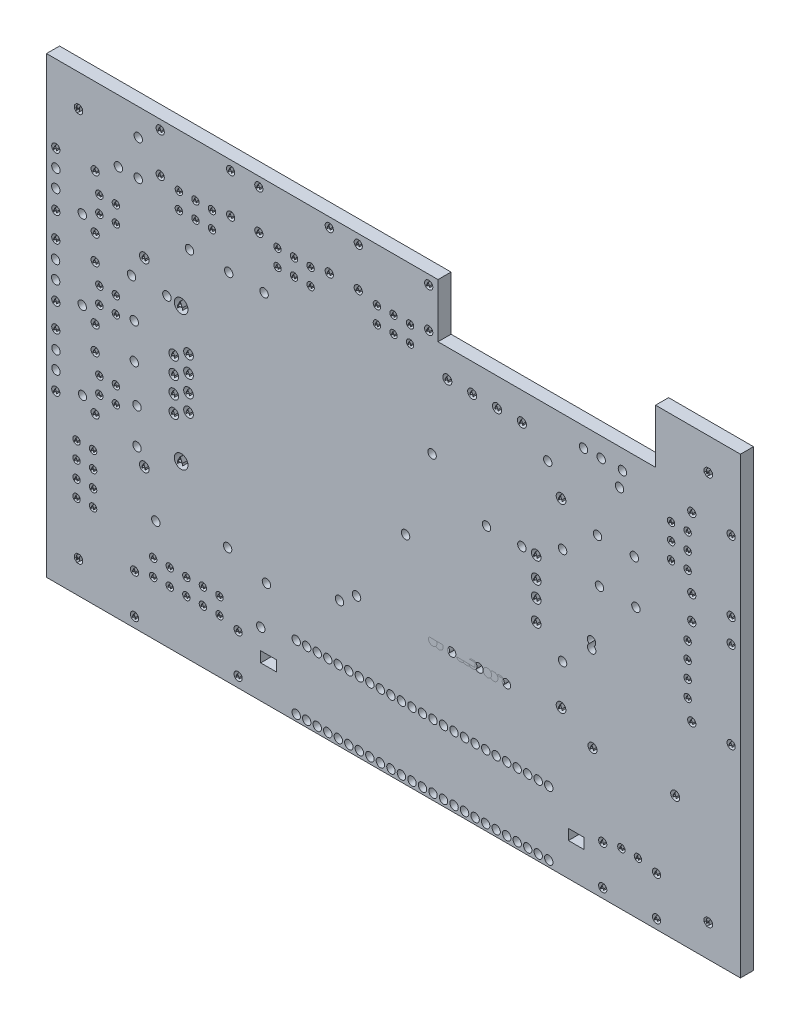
SolidWorks part; units mm, degrees
ref_plane "Front Plane" through (0, 0, 0) normal (0, 0, 1) x (1, 0, 0)
ref_plane "Top Plane" through (0, 0, 0) normal (0, 1, 0) x (1, 0, 0)
ref_plane "Right Plane" through (0, 0, 0) normal (1, 0, 0) x (0, 0, -1)
sketch "Model" plane through (0, 0, 0) normal (0, 0, 1) x (1, 0, 0)
  line L18 (0.127, 0.127) -> (83.8731, 0.127)
  line L19 (83.8731, 0.127) -> (83.8731, 54.8729)
  line L20 (83.8731, 54.8729) -> (73.627, 54.8729)
  line L21 (73.627, 54.8729) -> (73.627, 48.373)
  line L22 (73.627, 48.373) -> (47.373, 48.373)
  line L23 (47.373, 48.373) -> (47.373, 54.8729)
  line L24 (47.373, 54.8729) -> (0.127, 54.8729)
  line L25 (0.127, 54.8729) -> (0.127, 0.127)
  text T0 "A" font "TXT" height 0.4953
  text T1 "A" font "TXT" height 0.4953
  text T2 "A" font "TXT" height 0.4953
  text T3 "A" font "TXT" height 0.4953
  text T4 "A" font "TXT" height 0.4445
  text T5 "A" font "TXT" height 0.4445
  text T6 "A" font "TXT" height 0.4445
  text T7 "A" font "TXT" height 0.4445
  text T8 "A" font "TXT" height 0.4445
  text T9 "A" font "TXT" height 0.4445
  text T10 "A" font "TXT" height 0.4953
  text T11 "A" font "TXT" height 0.4953
  text T12 "A" font "TXT" height 0.4953
  text T13 "A" font "TXT" height 0.4953
  text T14 "A" font "TXT" height 0.4445
  text T15 "A" font "TXT" height 0.4445
  text T16 "A" font "TXT" height 0.4445
  text T17 "A" font "TXT" height 0.4445
  text T18 "A" font "TXT" height 0.4445
  text T19 "A" font "TXT" height 0.4445
  text T20 "A" font "TXT" height 0.4953
  text T21 "A" font "TXT" height 0.4953
  text T22 "A" font "TXT" height 0.4953
  text T23 "A" font "TXT" height 0.4953
  text T24 "A" font "TXT" height 0.4445
  text T25 "A" font "TXT" height 0.4445
  text T26 "A" font "TXT" height 0.4445
  text T27 "A" font "TXT" height 0.4445
  text T28 "A" font "TXT" height 0.4445
  text T29 "A" font "TXT" height 0.4445
  text T30 "A" font "TXT" height 0.4953
  text T31 "A" font "TXT" height 0.4953
  text T32 "A" font "TXT" height 0.4953
  text T33 "A" font "TXT" height 0.4953
  text T34 "A" font "TXT" height 0.4445
  text T35 "A" font "TXT" height 0.4445
  text T36 "A" font "TXT" height 0.4445
  text T37 "A" font "TXT" height 0.4445
  text T38 "A" font "TXT" height 0.4953
  text T39 "A" font "TXT" height 0.4953
  text T40 "A" font "TXT" height 0.4953
  text T41 "A" font "TXT" height 0.4953
  text T42 "A" font "TXT" height 0.4445
  text T43 "A" font "TXT" height 0.4445
  text T44 "A" font "TXT" height 0.4445
  text T45 "A" font "TXT" height 0.4445
  text T46 "A" font "TXT" height 0.4953
  text T47 "A" font "TXT" height 0.4953
  text T48 "A" font "TXT" height 0.4953
  text T49 "A" font "TXT" height 0.4953
  text T50 "A" font "TXT" height 0.4445
  text T51 "A" font "TXT" height 0.4445
  text T52 "A" font "TXT" height 0.4445
  text T53 "A" font "TXT" height 0.4445
  text T54 "A" font "TXT" height 0.4953
  text T55 "A" font "TXT" height 0.4953
  text T56 "A" font "TXT" height 0.4953
  text T57 "A" font "TXT" height 0.4953
  text T58 "A" font "TXT" height 0.4445
  text T59 "A" font "TXT" height 0.4445
  text T60 "A" font "TXT" height 0.4445
  text T61 "A" font "TXT" height 0.4445
  text T62 "A" font "TXT" height 0.4445
  text T63 "A" font "TXT" height 0.4445
  text T64 "A" font "TXT" height 0.4445
  text T65 "A" font "TXT" height 0.4445
  text T66 "A" font "TXT" height 0.4445
  text T67 "A" font "TXT" height 0.4445
  text T68 "A" font "TXT" height 0.5461
  text T69 "A" font "TXT" height 0.5461
  text T70 "A" font "TXT" height 0.5461
  text T71 "A" font "TXT" height 0.5461
  text T72 "M" font "TXT" height 0.5
  text T73 "M" font "TXT" height 0.5
  text T74 "M" font "TXT" height 0.5
  text T75 "M" font "TXT" height 0.5
  text T76 "A" font "TXT" height 0.5842
  text T77 "A" font "TXT" height 0.5842
  text T78 "A" font "TXT" height 0.5842
  text T79 "A" font "TXT" height 0.5842
  text T80 "A" font "TXT" height 0.5842
  text T81 "A" font "TXT" height 0.5842
  text T82 "A" font "TXT" height 0.5842
  text T83 "A" font "TXT" height 0.5842
  text T84 "A" font "TXT" height 0.8255
  text T85 "A" font "TXT" height 0.8255
  text T86 "A" font "TXT" height 0.5842
  text T87 "A" font "TXT" height 0.5842
  text T88 "A" font "TXT" height 0.5842
  text T89 "A" font "TXT" height 0.5842
  text T90 "A" font "TXT" height 0.5842
  text T91 "A" font "TXT" height 0.5842
  text T92 "A" font "TXT" height 0.5842
  text T93 "A" font "TXT" height 0.5842
  text T94 "A" font "TXT" height 0.4953
  text T95 "A" font "TXT" height 0.4953
  text T96 "A" font "TXT" height 0.4953
  text T97 "A" font "TXT" height 0.4953
  text T98 "A" font "TXT" height 0.4445
  text T99 "A" font "TXT" height 0.4445
  text T100 "A" font "TXT" height 0.4445
  text T101 "A" font "TXT" height 0.4445
  text T102 "A" font "TXT" height 0.4445
  text T103 "A" font "TXT" height 0.4445
  text T104 "A" font "TXT" height 0.4445
  text T105 "A" font "TXT" height 0.4445
  text T106 "A" font "TXT" height 0.4445
  text T107 "A" font "TXT" height 0.4445
  text T108 "A" font "TXT" height 0.4953
  text T109 "A" font "TXT" height 0.4953
  text T110 "A" font "TXT" height 0.4953
  text T111 "A" font "TXT" height 0.4953
  text T112 "A" font "TXT" height 0.4445
  text T113 "A" font "TXT" height 0.4445
  text T114 "A" font "TXT" height 0.4445
  text T115 "A" font "TXT" height 0.4445
  text T116 "A" font "TXT" height 0.4445
  text T117 "A" font "TXT" height 0.4445
  text T118 "A" font "TXT" height 0.5461
  text T119 "A" font "TXT" height 0.5461
  text T120 "A" font "TXT" height 0.4953
  text T121 "A" font "TXT" height 0.4953
  text T122 "A" font "TXT" height 0.4953
  text T123 "A" font "TXT" height 0.4953
  text T124 "A" font "TXT" height 0.4445
  text T125 "A" font "TXT" height 0.4445
  text T126 "A" font "TXT" height 0.4445
  text T127 "A" font "TXT" height 0.4445
  circle B0 centre (30.26, 0.8893) radius 0.508
  circle B1 centre (31.53, 0.8893) radius 0.508
  circle B2 centre (32.8, 0.8893) radius 0.508
  circle B3 centre (34.07, 0.8893) radius 0.508
  circle B4 centre (32.8, 8.6109) radius 0.508
  circle B5 centre (4.445, 40.2717) radius 0.508
  circle B6 centre (44.23, 0.8893) radius 0.508
  circle B7 centre (11.1999, 47.3664) radius 0.508
  circle B8 centre (10.3886, 36.8046) radius 0.508
  circle B9 centre (4.4323, 30.7213) radius 0.508
  circle B10 centre (10.7188, 32.2453) radius 0.508
  circle B11 centre (65.9, 26.3665) radius 0.508
  circle B12 centre (65.9181, 25.5499) radius 0.508
  circle B13 centre (41.69, 8.6109) radius 0.508
  circle B14 centre (4.4704, 21.3106) radius 0.4953
  circle B15 centre (11.049, 23.5204) radius 0.508
  circle B16 centre (40.42, 0.8893) radius 0.508
  circle B17 centre (37.88, 0.8893) radius 0.508
  circle B18 centre (8.8001, 47.3664) radius 0.508
  circle B19 centre (37.5437, 16.8923) radius 0.508
  circle B20 centre (11.049, 19.2532) radius 0.508
  circle B21 centre (35.34, 0.8893) radius 0.508
  circle B22 centre (13.3203, 12.5999) radius 0.508
  circle B23 centre (14.6558, 36.8046) radius 0.508
  circle B24 centre (17.3835, 42.9999) radius 0.508
  circle B25 centre (26.3835, 42.9999) radius 0.508
  circle B26 centre (48.04, 0.8893) radius 0.508
  circle B27 centre (51.85, 0.8893) radius 0.508
  circle B28 centre (55.66, 0.8893) radius 0.508
  circle B29 centre (59.47, 0.8893) radius 0.508
  circle B30 centre (10.7188, 27.9781) radius 0.508
  circle B31 centre (53.2257, 32.0421) radius 0.508
  circle B32 centre (49.31, 8.6109) radius 0.508
  circle B33 centre (53.1368, 8.6109) radius 0.508
  circle B34 centre (56.93, 8.6109) radius 0.508
  circle B35 centre (60.74, 8.6109) radius 0.508
  circle B36 centre (66.8569, 32.5603) radius 0.508
  circle B37 centre (71.2569, 32.5603) radius 0.508
  circle B38 centre (69.2798, 44.1) radius 0.508
  circle B39 centre (22.1163, 42.9999) radius 0.508
  circle B40 centre (11.1999, 51.6336) radius 0.508
  circle B41 centre (69.6331, 46.0332) radius 0.508
  circle B42 centre (71.0692, 37.7698) radius 0.508
  circle B43 centre (39.15, 0.8893) radius 0.508
  circle B44 centre (25.9842, 7.8486) radius 0.508
  circle B45 centre (26.67, 12.7762) radius 0.508
  circle B46 centre (67.0669, 46.0332) radius 0.508
  circle B47 centre (66.6242, 37.7698) radius 0.508
  circle B48 centre (30.26, 8.6109) radius 0.508
  circle B49 centre (62.4078, 22.4663) radius 0.508
  circle B50 centre (62.4078, 34.1884) radius 0.508
  circle B51 centre (1.27, 24.4856) radius 0.508
  circle B52 centre (1.27, 22.3774) radius 0.508
  circle B53 centre (1.2192, 33.909) radius 0.508
  circle B54 centre (1.2319, 31.7881) radius 0.508
  circle B55 centre (1.2573, 43.4594) radius 0.508
  circle B56 centre (1.2446, 41.3385) radius 0.508
  circle B57 centre (31.53, 8.6109) radius 0.508
  circle B58 centre (34.07, 8.6109) radius 0.508
  circle B59 centre (21.9817, 14.1747) radius 0.508
  circle B60 centre (35.3261, 8.6109) radius 0.508
  circle B61 centre (60.6184, 42.5252) radius 0.508
  circle B62 centre (46.6598, 36.2966) radius 0.508
  circle B63 centre (43.4594, 26.2636) radius 0.508
  circle B64 centre (35.4838, 15.3924) radius 0.508
  circle B65 centre (36.61, 0.8893) radius 0.508
  circle B66 centre (36.61, 8.6109) radius 0.508
  circle B67 centre (58.2, 0.8893) radius 0.508
  circle B68 centre (64.9333, 46.0332) radius 0.508
  circle B69 centre (58.2, 8.6109) radius 0.508
  circle B70 centre (59.47, 8.6109) radius 0.508
  circle B71 centre (60.74, 0.8893) radius 0.508
  circle B72 centre (46.77, 0.8893) radius 0.508
  circle B73 centre (47.498, 16.764) radius 0.508
  circle B74 centre (46.77, 8.6109) radius 0.508
  circle B75 centre (46.736, 16.764) radius 0.508
  circle B76 centre (48.04, 8.6109) radius 0.508
  circle B77 centre (48.26, 16.764) radius 0.508
  circle B78 centre (39.15, 8.6109) radius 0.508
  circle B79 centre (49.31, 0.8893) radius 0.508
  circle B80 centre (49.022, 16.764) radius 0.508
  circle B81 centre (50.58, 0.8893) radius 0.508
  circle B82 centre (50.8, 16.764) radius 0.508
  circle B83 centre (50.58, 8.6109) radius 0.508
  circle B84 centre (50.0634, 16.764) radius 0.508
  circle B85 centre (57.4929, 32.0421) radius 0.508
  circle B86 centre (45.5, 8.6109) radius 0.508
  circle B87 centre (37.88, 8.6109) radius 0.508
  circle B88 centre (45.5, 0.8893) radius 0.508
  circle B89 centre (56.93, 0.8893) radius 0.508
  circle B90 centre (55.626, 16.764) radius 0.508
  circle B91 centre (44.23, 8.6109) radius 0.508
  circle B92 centre (55.66, 8.6109) radius 0.508
  circle B93 centre (54.864, 16.764) radius 0.508
  circle B94 centre (42.96, 0.8893) radius 0.508
  circle B95 centre (54.39, 8.6109) radius 0.508
  circle B96 centre (53.34, 16.764) radius 0.508
  circle B97 centre (54.39, 0.8893) radius 0.508
  circle B98 centre (54.102, 16.764) radius 0.508
  circle B99 centre (40.42, 8.6109) radius 0.508
  circle B100 centre (41.69, 0.8893) radius 0.508
  circle B101 centre (42.96, 8.6109) radius 0.508
  circle B102 centre (53.12, 0.8893) radius 0.508
  circle B103 centre (52.324, 16.764) radius 0.508
  circle B104 centre (51.85, 8.6109) radius 0.508
  circle B105 centre (51.562, 16.764) radius 0.508
  circle B106 centre (46.2498, 49.0002) radius 0.4953
  circle B107 centre (46.2498, 53.75) radius 0.4953
  circle B108 centre (37.75, 53.75) radius 0.4953
  circle B109 centre (37.75, 49.0002) radius 0.4953
  circle B110 centre (41.9999, 48.5) radius 0.4445
  circle B111 centre (41.9999, 46.5) radius 0.4445
  circle B112 centre (39.9999, 48.5) radius 0.4445
  circle B113 centre (39.9999, 46.5) radius 0.4445
  circle B114 centre (43.9999, 46.5) radius 0.4445
  circle B115 centre (43.9999, 48.5) radius 0.4445
  circle B116 centre (34.2499, 49.0002) radius 0.4953
  circle B117 centre (34.2499, 53.75) radius 0.4953
  circle B118 centre (25.75, 53.75) radius 0.4953
  circle B119 centre (25.75, 49.0002) radius 0.4953
  circle B120 centre (29.9999, 48.5) radius 0.4445
  circle B121 centre (29.9999, 46.5) radius 0.4445
  circle B122 centre (27.9999, 48.5) radius 0.4445
  circle B123 centre (27.9999, 46.5) radius 0.4445
  circle B124 centre (31.9999, 46.5) radius 0.4445
  circle B125 centre (31.9999, 48.5) radius 0.4445
  circle B126 centre (22.35, 49.0002) radius 0.4953
  circle B127 centre (22.35, 53.75) radius 0.4953
  circle B128 centre (13.8501, 53.75) radius 0.4953
  circle B129 centre (13.8501, 49.0002) radius 0.4953
  circle B130 centre (18.1, 48.5) radius 0.4445
  circle B131 centre (18.1, 46.5) radius 0.4445
  circle B132 centre (16.1, 48.5) radius 0.4445
  circle B133 centre (16.1, 46.5) radius 0.4445
  circle B134 centre (20.1, 46.5) radius 0.4445
  circle B135 centre (20.1, 48.5) radius 0.4445
  circle B136 centre (6, 45.5498) radius 0.4953
  circle B137 centre (1.2502, 45.5498) radius 0.4953
  circle B138 centre (1.2502, 39.05) radius 0.4953
  circle B139 centre (6, 39.05) radius 0.4953
  circle B140 centre (6.5001, 43.2999) radius 0.4445
  circle B141 centre (8.5001, 43.2999) radius 0.4445
  circle B142 centre (6.5001, 41.2999) radius 0.4445
  circle B143 centre (8.5001, 41.2999) radius 0.4445
  circle B144 centre (6, 36.05) radius 0.4953
  circle B145 centre (1.2502, 36.05) radius 0.4953
  circle B146 centre (1.2502, 29.5501) radius 0.4953
  circle B147 centre (6, 29.5501) radius 0.4953
  circle B148 centre (6.5001, 33.8) radius 0.4445
  circle B149 centre (8.5001, 33.8) radius 0.4445
  circle B150 centre (6.5001, 31.8) radius 0.4445
  circle B151 centre (8.5001, 31.8) radius 0.4445
  circle B152 centre (6, 26.6499) radius 0.4953
  circle B153 centre (1.2502, 26.6499) radius 0.4953
  circle B154 centre (1.2502, 20.1501) radius 0.4953
  circle B155 centre (6, 20.1501) radius 0.4953
  circle B156 centre (6.5001, 24.4) radius 0.4445
  circle B157 centre (8.5001, 24.4) radius 0.4445
  circle B158 centre (6.5001, 22.4) radius 0.4445
  circle B159 centre (8.5001, 22.4) radius 0.4445
  circle B160 centre (10.75, 6.0998) radius 0.4953
  circle B161 centre (10.75, 1.35) radius 0.4953
  circle B162 centre (23.2499, 1.35) radius 0.4953
  circle B163 centre (23.2499, 6.0998) radius 0.4953
  circle B164 centre (13, 6.5999) radius 0.4445
  circle B165 centre (13, 8.5999) radius 0.4445
  circle B166 centre (15, 6.5999) radius 0.4445
  circle B167 centre (15, 8.5999) radius 0.4445
  circle B168 centre (17, 6.5999) radius 0.4445
  circle B169 centre (17, 8.5999) radius 0.4445
  circle B170 centre (19, 6.5999) radius 0.4445
  circle B171 centre (19, 8.5999) radius 0.4445
  circle B172 centre (21, 6.5999) radius 0.4445
  circle B173 centre (21, 8.5999) radius 0.4445
  line B174 (25.9801, 4.1151) -> (25.9801, 5.3851)
  line B175 (25.9801, 5.3851) -> (27.8851, 5.3851)
  line B176 (27.8851, 5.3851) -> (27.8851, 4.1151)
  line B177 (27.8851, 4.1151) -> (25.9801, 4.1151)
  line B178 (63.1149, 4.1151) -> (63.1149, 5.3851)
  line B179 (63.1149, 5.3851) -> (65.0199, 5.3851)
  line B180 (65.0199, 5.3851) -> (65.0199, 4.1151)
  line B181 (65.0199, 4.1151) -> (63.1149, 4.1151)
  circle B182 centre (57.5, 44.9999) radius 0.5461
  circle B183 centre (54.5, 44.9999) radius 0.5461
  circle B184 centre (51.5, 44.9999) radius 0.5461
  circle B185 centre (48.5, 44.9999) radius 0.5461
  line B186 (3.5, 3.7929) -> (3.5, 4.2071)
  line B187 (3.5, 4.2071) -> (3.7929, 4.5)
  line B188 (3.7929, 4.5) -> (4.2071, 4.5)
  line B189 (4.2071, 4.5) -> (4.5, 4.2071)
  line B190 (4.5, 4.2071) -> (4.5, 3.7929)
  line B191 (4.5, 3.7929) -> (4.2071, 3.5)
  line B192 (4.2071, 3.5) -> (3.7929, 3.5)
  line B193 (3.7929, 3.5) -> (3.5, 3.7929)
  line B194 (79.5001, 3.7929) -> (79.5001, 4.2071)
  line B195 (79.5001, 4.2071) -> (79.793, 4.5)
  line B196 (79.793, 4.5) -> (80.2072, 4.5)
  line B197 (80.2072, 4.5) -> (80.5001, 4.2071)
  line B198 (80.5001, 4.2071) -> (80.5001, 3.7929)
  line B199 (80.5001, 3.7929) -> (80.2072, 3.5)
  line B200 (80.2072, 3.5) -> (79.793, 3.5)
  line B201 (79.793, 3.5) -> (79.5001, 3.7929)
  line B202 (79.5001, 50.7928) -> (79.5001, 51.207)
  line B203 (79.5001, 51.207) -> (79.793, 51.4999)
  line B204 (79.793, 51.4999) -> (80.2072, 51.4999)
  line B205 (80.2072, 51.4999) -> (80.5001, 51.207)
  line B206 (80.5001, 51.207) -> (80.5001, 50.7928)
  line B207 (80.5001, 50.7928) -> (80.2072, 50.4999)
  line B208 (80.2072, 50.4999) -> (79.793, 50.4999)
  line B209 (79.793, 50.4999) -> (79.5001, 50.7928)
  line B210 (3.5, 50.7928) -> (3.5, 51.207)
  line B211 (3.5, 51.207) -> (3.7929, 51.4999)
  line B212 (3.7929, 51.4999) -> (4.2071, 51.4999)
  line B213 (4.2071, 51.4999) -> (4.5, 51.207)
  line B214 (4.5, 51.207) -> (4.5, 50.7928)
  line B215 (4.5, 50.7928) -> (4.2071, 50.4999)
  line B216 (4.2071, 50.4999) -> (3.7929, 50.4999)
  line B217 (3.7929, 50.4999) -> (3.5, 50.7928)
  circle B218 centre (59.2249, 24.9949) radius 0.5842
  circle B219 centre (59.2249, 27.5095) radius 0.5842
  circle B220 centre (59.2249, 29.4907) radius 0.5842
  circle B221 centre (59.2249, 32.0053) radius 0.5842
  circle B222 centre (62.2221, 39.4221) radius 0.5842
  circle B223 centre (62.2221, 17.5781) radius 0.5842
  circle B224 centre (11.9301, 39.4221) radius 0.5842
  circle B225 centre (11.9301, 17.5781) radius 0.5842
  circle B226 centre (16.3751, 20.3721) radius 0.8255
  circle B227 centre (16.3751, 36.6281) radius 0.8255
  circle B228 centre (17.2641, 25.9601) radius 0.5842
  circle B229 centre (17.2641, 27.9921) radius 0.5842
  circle B230 centre (17.2641, 30.0241) radius 0.5842
  circle B231 centre (17.2641, 32.0561) radius 0.5842
  circle B232 centre (15.4861, 31.0401) radius 0.5842
  circle B233 centre (15.4861, 29.0081) radius 0.5842
  circle B234 centre (15.4861, 26.9761) radius 0.5842
  circle B235 centre (15.4861, 24.9441) radius 0.5842
  line B236 (36.3731, 12.1999) -> (36.6271, 12.1999)
  line B237 (36.5001, 12.3269) -> (36.5001, 12.0729)
  circle B238 centre (67.2501, 6) radius 0.4953
  circle B239 centre (67.2501, 1.2502) radius 0.4953
  circle B240 centre (73.7499, 1.2502) radius 0.4953
  circle B241 centre (73.7499, 6) radius 0.4953
  circle B242 centre (69.5, 6.5001) radius 0.4445
  circle B243 centre (71.5, 6.5001) radius 0.4445
  circle B244 centre (5.7501, 16.2499) radius 0.4445
  circle B245 centre (5.7501, 14.2499) radius 0.4445
  circle B246 centre (5.7501, 12.2499) radius 0.4445
  circle B247 centre (5.7501, 10.2499) radius 0.4445
  circle B248 centre (3.7501, 16.2499) radius 0.4445
  circle B249 centre (3.7501, 14.2499) radius 0.4445
  circle B250 centre (3.7501, 12.2499) radius 0.4445
  circle B251 centre (3.7501, 10.2499) radius 0.4445
  circle B252 centre (78.0001, 37.3502) radius 0.4953
  circle B253 centre (82.7499, 37.3502) radius 0.4953
  circle B254 centre (82.7499, 45.85) radius 0.4953
  circle B255 centre (78.0001, 45.85) radius 0.4953
  circle B256 centre (77.5, 41.6001) radius 0.4445
  circle B257 centre (75.5094, 41.6067) radius 0.4445
  circle B258 centre (77.5, 43.6001) radius 0.4445
  circle B259 centre (75.5, 43.6001) radius 0.4445
  circle B260 centre (75.5, 39.6001) radius 0.4445
  circle B261 centre (77.5, 39.6001) radius 0.4445
  circle B262 centre (66.0179, 15.2499) radius 0.5461
  circle B263 centre (76.0001, 15.2499) radius 0.5461
  circle B264 centre (78.0001, 23.9502) radius 0.4953
  circle B265 centre (82.7499, 23.9502) radius 0.4953
  circle B266 centre (82.7499, 34.45) radius 0.4953
  circle B267 centre (78.0001, 34.45) radius 0.4953
  circle B268 centre (77.5, 30.2001) radius 0.4445
  circle B269 centre (77.5, 32.2001) radius 0.4445
  circle B270 centre (77.5, 28.2001) radius 0.4445
  circle B271 centre (77.5, 26.2001) radius 0.4445
sketch_block_instance "FIGURE_CIRCLE-1"
sketch_block "FIGURE_CIRCLE"
sketch_block_instance "FIGURE_CIRCLE-2"
sketch_block_instance "FIGURE_CIRCLE-3"
sketch_block_instance "FIGURE_CIRCLE-4"
sketch_block_instance "FIGURE_CIRCLE-5"
sketch_block_instance "FIGURE_CIRCLE-6"
sketch_block_instance "FIGURE_CIRCLE-7"
sketch_block_instance "FIGURE_CIRCLE-8"
sketch_block_instance "FIGURE_CIRCLE-9"
sketch_block_instance "FIGURE_CIRCLE-10"
sketch_block_instance "FIGURE_CIRCLE-11"
sketch_block_instance "FIGURE_CIRCLE-12"
sketch_block_instance "FIGURE_CIRCLE-13"
sketch_block_instance "FIGURE_CIRCLE-14"
sketch_block_instance "FIGURE_CIRCLE-15"
sketch_block_instance "FIGURE_CIRCLE-16"
sketch_block_instance "FIGURE_CIRCLE-17"
sketch_block_instance "FIGURE_CIRCLE-18"
sketch_block_instance "FIGURE_CIRCLE-19"
sketch_block_instance "FIGURE_CIRCLE-20"
sketch_block_instance "FIGURE_CIRCLE-21"
sketch_block_instance "FIGURE_CIRCLE-22"
sketch_block_instance "FIGURE_CIRCLE-23"
sketch_block_instance "FIGURE_CIRCLE-24"
sketch_block_instance "FIGURE_CIRCLE-25"
sketch_block_instance "FIGURE_CIRCLE-26"
sketch_block_instance "FIGURE_CIRCLE-27"
sketch_block_instance "FIGURE_CIRCLE-28"
sketch_block_instance "FIGURE_CIRCLE-29"
sketch_block_instance "FIGURE_CIRCLE-30"
sketch_block_instance "FIGURE_CIRCLE-31"
sketch_block_instance "FIGURE_CIRCLE-32"
sketch_block_instance "FIGURE_CIRCLE-33"
sketch_block_instance "FIGURE_CIRCLE-34"
sketch_block_instance "FIGURE_CIRCLE-35"
sketch_block_instance "FIGURE_CIRCLE-36"
sketch_block_instance "FIGURE_CIRCLE-37"
sketch_block_instance "FIGURE_CIRCLE-38"
sketch_block_instance "FIGURE_CIRCLE-39"
sketch_block_instance "FIGURE_CIRCLE-40"
sketch_block_instance "FIGURE_CIRCLE-41"
sketch_block_instance "FIGURE_CIRCLE-42"
sketch_block_instance "FIGURE_CIRCLE-43"
sketch_block_instance "FIGURE_CIRCLE-44"
sketch_block_instance "FIGURE_CIRCLE-45"
sketch_block_instance "FIGURE_CIRCLE-46"
sketch_block_instance "FIGURE_CIRCLE-47"
sketch_block_instance "FIGURE_CIRCLE-48"
sketch_block_instance "FIGURE_CIRCLE-49"
sketch_block_instance "FIGURE_CIRCLE-50"
sketch_block_instance "FIGURE_CIRCLE-51"
sketch_block_instance "FIGURE_CIRCLE-52"
sketch_block_instance "FIGURE_CIRCLE-53"
sketch_block_instance "FIGURE_CIRCLE-54"
sketch_block_instance "FIGURE_CIRCLE-55"
sketch_block_instance "FIGURE_CIRCLE-56"
sketch_block_instance "FIGURE_CIRCLE-57"
sketch_block_instance "FIGURE_CIRCLE-58"
sketch_block_instance "FIGURE_CIRCLE-59"
sketch_block_instance "FIGURE_CIRCLE-60"
sketch_block_instance "FIGURE_CIRCLE-61"
sketch_block_instance "FIGURE_CIRCLE-62"
sketch_block_instance "FIGURE_CIRCLE-63"
sketch_block_instance "FIGURE_CIRCLE-64"
sketch_block_instance "FIGURE_CIRCLE-65"
sketch_block_instance "FIGURE_CIRCLE-66"
sketch_block_instance "FIGURE_CIRCLE-67"
sketch_block_instance "FIGURE_CIRCLE-68"
sketch_block_instance "FIGURE_CIRCLE-69"
sketch_block_instance "FIGURE_CIRCLE-70"
sketch_block_instance "FIGURE_CIRCLE-71"
sketch_block_instance "FIGURE_CIRCLE-72"
sketch_block_instance "FIGURE_CIRCLE-73"
sketch_block_instance "FIGURE_CIRCLE-74"
sketch_block_instance "FIGURE_CIRCLE-75"
sketch_block_instance "FIGURE_CIRCLE-76"
sketch_block_instance "FIGURE_CIRCLE-77"
sketch_block_instance "FIGURE_CIRCLE-78"
sketch_block_instance "FIGURE_CIRCLE-79"
sketch_block_instance "FIGURE_CIRCLE-80"
sketch_block_instance "FIGURE_CIRCLE-81"
sketch_block_instance "FIGURE_CIRCLE-82"
sketch_block_instance "FIGURE_CIRCLE-83"
sketch_block_instance "FIGURE_CIRCLE-84"
sketch_block_instance "FIGURE_CIRCLE-85"
sketch_block_instance "FIGURE_CIRCLE-86"
sketch_block_instance "FIGURE_CIRCLE-87"
sketch_block_instance "FIGURE_CIRCLE-88"
sketch_block_instance "FIGURE_CIRCLE-89"
sketch_block_instance "FIGURE_CIRCLE-90"
sketch_block_instance "FIGURE_CIRCLE-91"
sketch_block_instance "FIGURE_CIRCLE-92"
sketch_block_instance "FIGURE_CIRCLE-93"
sketch_block_instance "FIGURE_CIRCLE-94"
sketch_block_instance "FIGURE_CIRCLE-95"
sketch_block_instance "FIGURE_CIRCLE-96"
sketch_block_instance "FIGURE_CIRCLE-97"
sketch_block_instance "FIGURE_CIRCLE-98"
sketch_block_instance "FIGURE_CIRCLE-99"
sketch_block_instance "FIGURE_CIRCLE-100"
sketch_block_instance "FIGURE_CIRCLE-101"
sketch_block_instance "FIGURE_CIRCLE-102"
sketch_block_instance "FIGURE_CIRCLE-103"
sketch_block_instance "FIGURE_CIRCLE-104"
sketch_block_instance "FIGURE_CIRCLE-105"
sketch_block_instance "FIGURE_CIRCLE-106"
sketch_block_instance "FIGURE_CIRCLE-107"
sketch_block_instance "FIGURE_CIRCLE-108"
sketch_block_instance "FIGURE_CIRCLE-109"
sketch_block_instance "FIGURE_CIRCLE-110"
sketch_block_instance "FIGURE_CIRCLE-111"
sketch_block_instance "FIGURE_CIRCLE-112"
sketch_block_instance "FIGURE_CIRCLE-113"
sketch_block_instance "FIGURE_CIRCLE-114"
sketch_block_instance "FIGURE_CIRCLE-115"
sketch_block_instance "FIGURE_CIRCLE-116"
sketch_block_instance "FIGURE_CIRCLE-117"
sketch_block_instance "FIGURE_CIRCLE-118"
sketch_block_instance "FIGURE_CIRCLE-119"
sketch_block_instance "FIGURE_CIRCLE-120"
sketch_block_instance "FIGURE_CIRCLE-121"
sketch_block_instance "FIGURE_CIRCLE-122"
sketch_block_instance "FIGURE_CIRCLE-123"
sketch_block_instance "FIGURE_CIRCLE-124"
sketch_block_instance "FIGURE_CIRCLE-125"
sketch_block_instance "FIGURE_CIRCLE-126"
sketch_block_instance "FIGURE_CIRCLE-127"
sketch_block_instance "FIGURE_CIRCLE-128"
sketch_block_instance "FIGURE_CIRCLE-129"
sketch_block_instance "FIGURE_CIRCLE-130"
sketch_block_instance "FIGURE_CIRCLE-131"
sketch_block_instance "FIGURE_CIRCLE-132"
sketch_block_instance "FIGURE_CIRCLE-133"
sketch_block_instance "FIGURE_CIRCLE-134"
sketch_block_instance "FIGURE_CIRCLE-135"
sketch_block_instance "FIGURE_CIRCLE-136"
sketch_block_instance "FIGURE_CIRCLE-137"
sketch_block_instance "FIGURE_CIRCLE-138"
sketch_block_instance "FIGURE_CIRCLE-139"
sketch_block_instance "FIGURE_CIRCLE-140"
sketch_block_instance "FIGURE_CIRCLE-141"
sketch_block_instance "FIGURE_CIRCLE-142"
sketch_block_instance "FIGURE_CIRCLE-143"
sketch_block_instance "FIGURE_CIRCLE-144"
sketch_block_instance "FIGURE_CIRCLE-145"
sketch_block_instance "FIGURE_CIRCLE-146"
sketch_block_instance "FIGURE_CIRCLE-147"
sketch_block_instance "FIGURE_CIRCLE-148"
sketch_block_instance "FIGURE_CIRCLE-149"
sketch_block_instance "FIGURE_CIRCLE-150"
sketch_block_instance "FIGURE_CIRCLE-151"
sketch_block_instance "FIGURE_CIRCLE-152"
sketch_block_instance "FIGURE_CIRCLE-153"
sketch_block_instance "FIGURE_CIRCLE-154"
sketch_block_instance "FIGURE_CIRCLE-155"
sketch_block_instance "FIGURE_CIRCLE-156"
sketch_block_instance "FIGURE_CIRCLE-157"
sketch_block_instance "FIGURE_CIRCLE-158"
sketch_block_instance "FIGURE_CIRCLE-159"
sketch_block_instance "FIGURE_CIRCLE-160"
sketch_block_instance "FIGURE_CIRCLE-161"
sketch_block_instance "FIGURE_CIRCLE-162"
sketch_block_instance "FIGURE_CIRCLE-163"
sketch_block_instance "FIGURE_CIRCLE-164"
sketch_block_instance "FIGURE_CIRCLE-165"
sketch_block_instance "FIGURE_CIRCLE-166"
sketch_block_instance "FIGURE_CIRCLE-167"
sketch_block_instance "FIGURE_CIRCLE-168"
sketch_block_instance "FIGURE_CIRCLE-169"
sketch_block_instance "FIGURE_CIRCLE-170"
sketch_block_instance "FIGURE_CIRCLE-171"
sketch_block_instance "FIGURE_CIRCLE-172"
sketch_block_instance "FIGURE_CIRCLE-173"
sketch_block_instance "FIGURE_CIRCLE-174"
sketch_block_instance "FIGURE_SQUARE_0-1"
sketch_block "FIGURE_SQUARE_0"
sketch_block_instance "FIGURE_SQUARE_1-1"
sketch_block "FIGURE_SQUARE_1"
sketch_block_instance "FIGURE_CIRCLE-175"
sketch_block_instance "FIGURE_CIRCLE-176"
sketch_block_instance "FIGURE_CIRCLE-177"
sketch_block_instance "FIGURE_CIRCLE-178"
sketch_block_instance "FIGURE_OCT-1"
sketch_block "FIGURE_OCT"
sketch_block_instance "FIGURE_OCT-2"
sketch_block_instance "FIGURE_OCT-3"
sketch_block_instance "FIGURE_OCT-4"
sketch_block_instance "FIGURE_CIRCLE-179"
sketch_block_instance "FIGURE_CIRCLE-180"
sketch_block_instance "FIGURE_CIRCLE-181"
sketch_block_instance "FIGURE_CIRCLE-182"
sketch_block_instance "FIGURE_CIRCLE-183"
sketch_block_instance "FIGURE_CIRCLE-184"
sketch_block_instance "FIGURE_CIRCLE-185"
sketch_block_instance "FIGURE_CIRCLE-186"
sketch_block_instance "FIGURE_CIRCLE-187"
sketch_block_instance "FIGURE_CIRCLE-188"
sketch_block_instance "FIGURE_CIRCLE-189"
sketch_block_instance "FIGURE_CIRCLE-190"
sketch_block_instance "FIGURE_CIRCLE-191"
sketch_block_instance "FIGURE_CIRCLE-192"
sketch_block_instance "FIGURE_CIRCLE-193"
sketch_block_instance "FIGURE_CIRCLE-194"
sketch_block_instance "FIGURE_CIRCLE-195"
sketch_block_instance "FIGURE_CIRCLE-196"
sketch_block_instance "FIGURE_CROSS-1"
sketch_block "FIGURE_CROSS"
sketch_block_instance "FIGURE_CROSS-2"
sketch_block_instance "FIGURE_CROSS-3"
sketch_block_instance "FIGURE_CROSS-4"
sketch_block_instance "FIGURE_CROSS-5"
sketch_block_instance "FIGURE_CROSS-6"
sketch_block_instance "FIGURE_CIRCLE-197"
sketch_block_instance "FIGURE_CIRCLE-198"
sketch_block_instance "FIGURE_CIRCLE-199"
sketch_block_instance "FIGURE_CIRCLE-200"
sketch_block_instance "FIGURE_CIRCLE-201"
sketch_block_instance "FIGURE_CIRCLE-202"
sketch_block_instance "FIGURE_CIRCLE-203"
sketch_block_instance "FIGURE_CIRCLE-204"
sketch_block_instance "FIGURE_CIRCLE-205"
sketch_block_instance "FIGURE_CIRCLE-206"
sketch_block_instance "FIGURE_CIRCLE-207"
sketch_block_instance "FIGURE_CIRCLE-208"
sketch_block_instance "FIGURE_CIRCLE-209"
sketch_block_instance "FIGURE_CIRCLE-210"
sketch_block_instance "FIGURE_CIRCLE-211"
sketch_block_instance "FIGURE_CIRCLE-212"
sketch_block_instance "FIGURE_CIRCLE-213"
sketch_block_instance "FIGURE_CIRCLE-214"
sketch_block_instance "FIGURE_CIRCLE-215"
sketch_block_instance "FIGURE_CIRCLE-216"
sketch_block_instance "FIGURE_CIRCLE-217"
sketch_block_instance "FIGURE_CIRCLE-218"
sketch_block_instance "FIGURE_CIRCLE-219"
sketch_block_instance "FIGURE_CIRCLE-220"
sketch_block_instance "FIGURE_CIRCLE-221"
sketch_block_instance "FIGURE_CIRCLE-222"
sketch_block_instance "FIGURE_CIRCLE-223"
sketch_block_instance "FIGURE_CIRCLE-224"
sketch_block_instance "FIGURE_CIRCLE-225"
sketch_block_instance "FIGURE_CIRCLE-226"
sketch_block_instance "FIGURE_CIRCLE-227"
sketch_block_instance "FIGURE_CIRCLE-228"
sketch_block_instance "FIGURE_CIRCLE-229"
sketch_block_instance "FIGURE_CIRCLE-230"
extrude "Boss-Extrude2" add sketch "Model" along normal blind 1.5748
